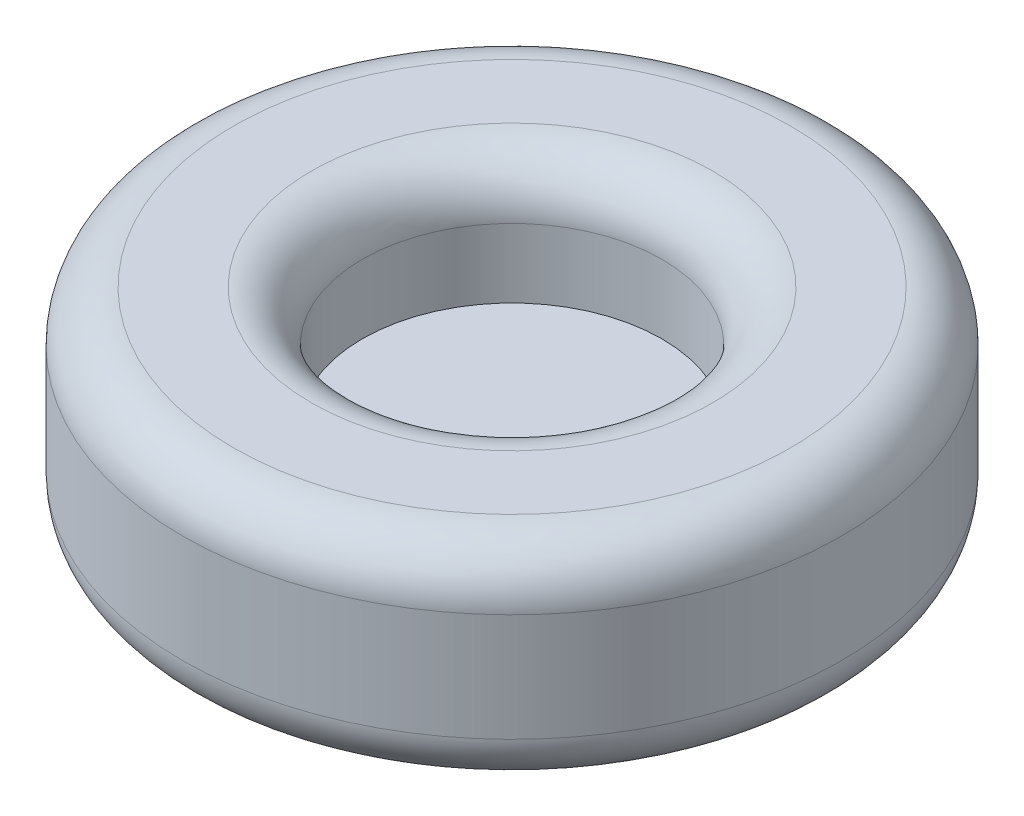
SolidWorks part; units mm, degrees
ref_plane "Front Plane" through (0, 0, 0) normal (0, 0, 1) x (1, 0, 0)
ref_plane "Top Plane" through (0, 0, 0) normal (0, 1, 0) x (1, 0, 0)
ref_plane "Right Plane" through (0, 0, 0) normal (1, 0, 0) x (0, 0, -1)
sketch "Sketch1" plane through (0, 0, 0) normal (0, 1, 0) x (1, 0, 0)
  circle A0 centre (0, 0) radius 279.4
  dimension "D1" = 558.8
extrude "Boss-Extrude1" add sketch "Sketch1" along normal blind 101.6 and the other way blind 76.2
fillet "Fillet1" radius 43.18 2 edges at (0, -76.2, 279.4) (0, 101.6, 279.4)
sketch "Sketch2" plane through (0, 101.6, 0) normal (0, 1, 0) x (1, 0, 0)
  circle A0 centre (0, 0) radius 127
  dimension "D1" = 254
extrude "Cut-Extrude1" cut sketch "Sketch2" against normal blind 101.6
fillet "Fillet2" radius 43.18 1 edges at (0, 101.6, 127)
